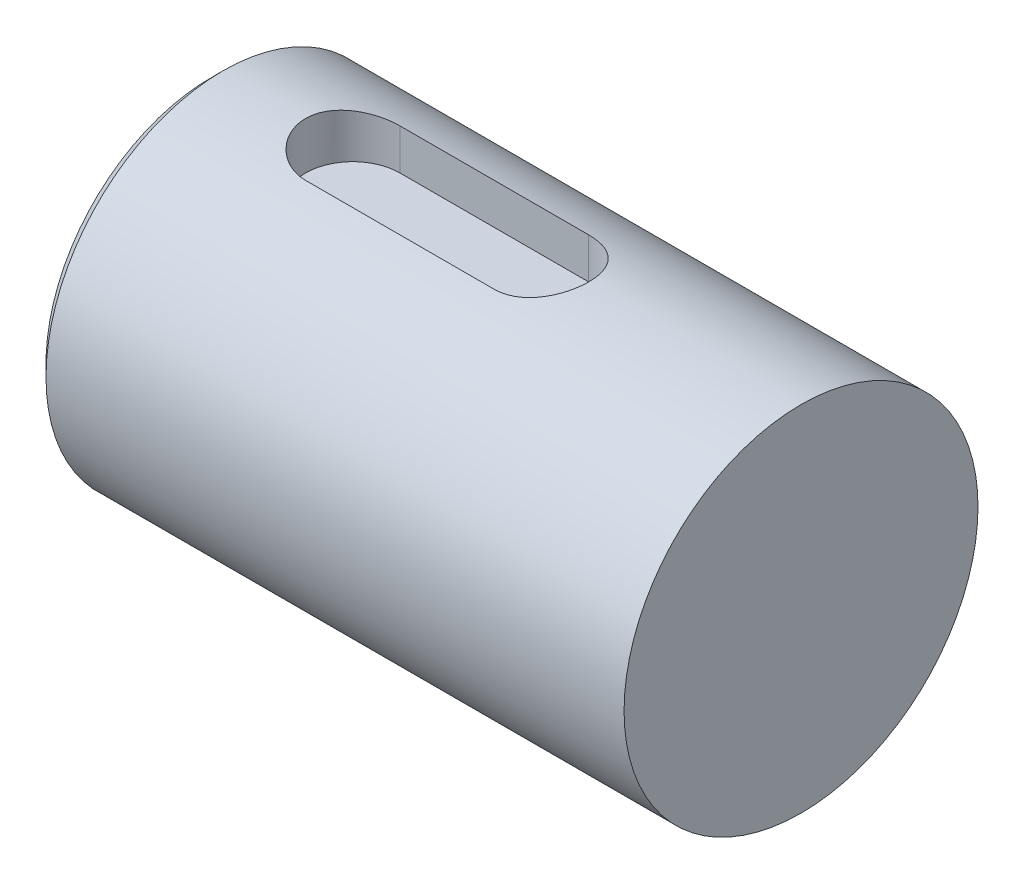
SolidWorks part; units mm, degrees
ref_plane "Plan de face" through (0, 0, 0) normal (0, 0, 1) x (1, 0, 0)
ref_plane "Plan de dessus" through (0, 0, 0) normal (0, 1, 0) x (1, 0, 0)
ref_plane "Plan de droite" through (0, 0, 0) normal (1, 0, 0) x (0, 0, -1)
sketch "Esquisse1" plane through (0, 0, 0) normal (0, 0, 1) x (1, 0, 0)
  line L0 (0, 0) -> (77.4866, 0) construction
  line L2 (0, 0) -> (50, 0)
  line L3 (0, 0) -> (0, 15)
  line L4 (0, 15) -> (50, 15)
  line L5 (50, 0) -> (50, 15)
  dimension "D1" = 15
  dimension "D2" = 50
revolve "Révolution1" add sketch "Esquisse1" angle 360 about L0
chamfer "Chanfrein1" distance 1 angle 45 1 edges at (0, 0, 15)
ref_plane "Plan1" through (0, 15, 0) normal (0, 1, 0) x (-1, 0, 0)
sketch "Esquisse2" plane through (0, 15, 0) normal (0, 1, 0) x (-1, 0, 0)
  line L0 (0, 0) -> (-35.3939, 0) construction
  line L1 (-28, 4) -> (-12, 4)
  line L2 (-28, -4) -> (-12, -4)
  line L3 (0, -14) -> (0, 14) construction
  arc A0 (-28, -4) -> (-28, 4) centre (-28, 0) cw
  arc A1 (-12, -4) -> (-12, 4) centre (-12, 0) ccw
  dimension "D1" = 4
  dimension "D2" = 12
  dimension "D3" = 16
extrude "Enlèv. mat.-Extru.1" cut sketch "Esquisse2" against normal blind 4
